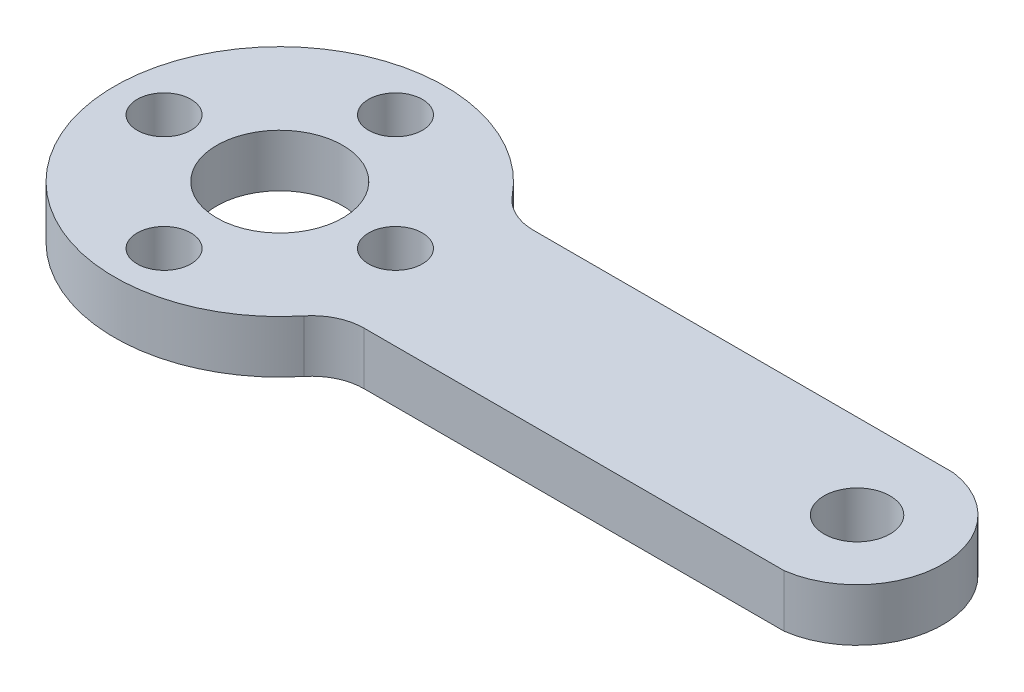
SolidWorks part; units mm, degrees
ref_plane "Front Plane" through (0, 0, 0) normal (0, 0, 1) x (1, 0, 0)
ref_plane "Top Plane" through (0, 0, 0) normal (0, 1, 0) x (1, 0, 0)
ref_plane "Right Plane" through (0, 0, 0) normal (1, 0, 0) x (0, 0, -1)
sketch "Sketch1" plane through (0, 0, 0) normal (0, 1, 0) x (1, 0, 0)
  line L0 (0, 0) -> (34.925, 0) construction
  line L1 (1.3815, 9.9041) -> (35.6399, 5.1254) construction
  line L2 (1.3815, -9.9041) -> (35.6399, -5.1254) construction
  line L3 (35.6399, 5.1254) -> (8.5866, 5.1254)
  line L4 (35.6399, -5.1254) -> (8.5866, -5.1254)
  arc A0 (1.3815, 9.9041) -> (1.3815, -9.9041) centre (0, 0) ccw
  arc A1 (35.6399, -5.1254) -> (35.6399, 5.1254) centre (34.925, 0) ccw
  circle A2 centre (34.925, 0) radius 2
  circle A3 centre (0, 0) radius 7 construction
  circle A4 centre (0, 7) radius 1.627
  circle A5 centre (7, 0) radius 1.627
  circle A6 centre (0, -7) radius 1.627
  circle A7 centre (-7, 0) radius 1.627
  circle A8 centre (0, 0) radius 3.81
  arc A9 (1.3815, 9.9041) -> (8.5866, 5.1254) centre (0, 0) cw
  arc A10 (1.3815, -9.9041) -> (8.5866, -5.1254) centre (0, 0) ccw
  point P17 (8.602, 5.1254)
  point P21 (8.9609, 5.0995)
  dimension "D1" = 20
  dimension "D3" = 14
  dimension "D4" = 3.254
  dimension "D5" = 4
  dimension "D6" = 3.175
  dimension "D7" = 7.62
  dimension "D2" = 34.925
extrude "Boss-Extrude1" add sketch "Sketch1" along normal blind 3.175
fillet "Fillet1" radius 3.175 2 edges at (8.5866, 1.5875, 5.1254) (8.5866, 1.5875, -5.1254)
